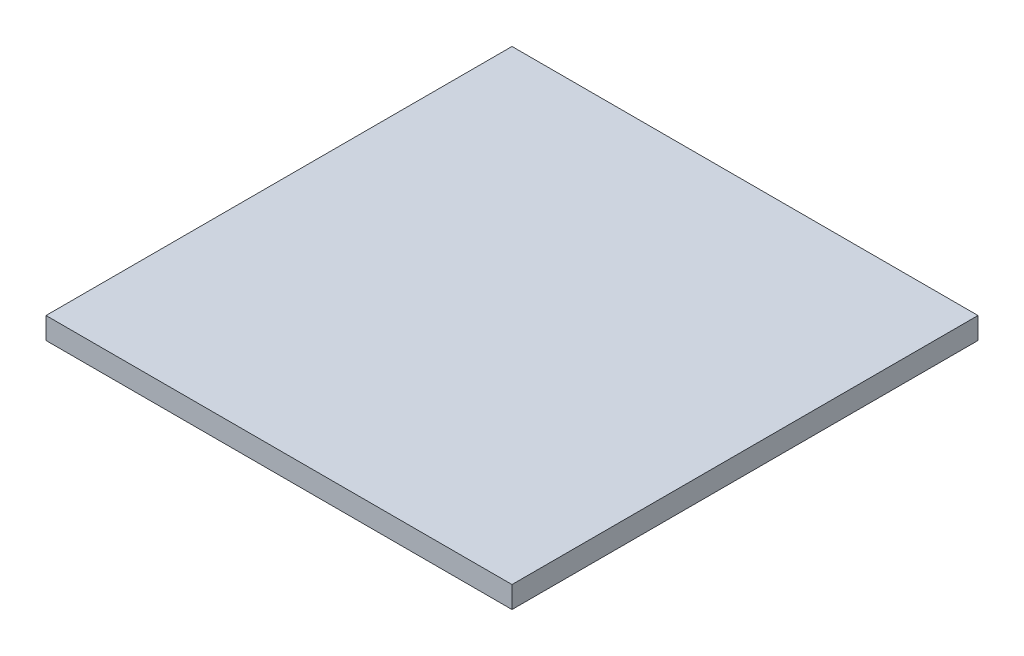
SolidWorks part; units mm, degrees
ref_plane "Front Plane" through (0, 0, 0) normal (0, 0, 1) x (1, 0, 0)
ref_plane "Top Plane" through (0, 0, 0) normal (0, 1, 0) x (1, 0, 0)
ref_plane "Right Plane" through (0, 0, 0) normal (1, 0, 0) x (0, 0, -1)
sketch "Sketch1" plane through (0, 0, 0) normal (0, 1, 0) x (1, 0, 0)
  line L1 (-21.5, -21.5) -> (21.5, -21.5)
  line L2 (-21.5, -21.5) -> (-21.5, 21.5)
  line L3 (-21.5, 21.5) -> (21.5, 21.5)
  line L4 (21.5, -21.5) -> (21.5, 21.5)
  line L5 (-21.5, -21.5) -> (21.5, 21.5) construction
  line L6 (-21.5, 21.5) -> (21.5, -21.5) construction
  point P0 (0, 0)
  dimension "D1" = 43
  dimension "D2" = 43
extrude "Boss-Extrude1" add sketch "Sketch1" along normal blind 2
